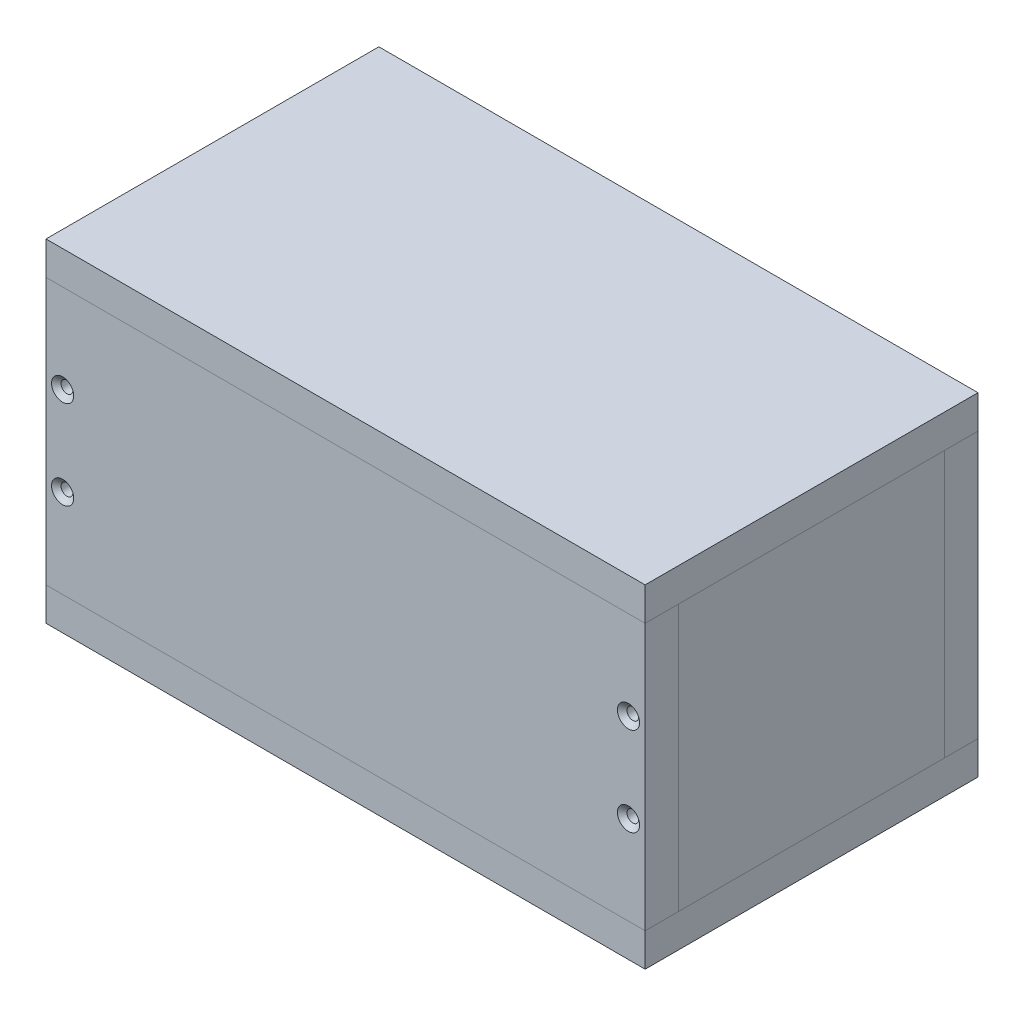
SolidWorks part; units mm, degrees
ref_plane "Front Plane" through (0, 0, 0) normal (0, 0, 1) x (1, 0, 0)
ref_plane "Top Plane" through (0, 0, 0) normal (0, 1, 0) x (1, 0, 0)
ref_plane "Right Plane" through (0, 0, 0) normal (1, 0, 0) x (0, 0, -1)
sketch "Sketch1" plane through (0, 0, 0) normal (0, 1, 0) x (1, 0, 0)
  line L0 (-108.3844, 121.84) -> (-95.6844, 121.84) construction
  line L1 (-101.6, -50.8) -> (101.6, -50.8) construction
  line L2 (-101.6, -50.8) -> (-101.6, 50.8) construction
  line L3 (-101.6, 50.8) -> (101.6, 50.8) construction
  line L4 (101.6, -50.8) -> (101.6, 50.8) construction
  line L5 (-114.3, 63.5) -> (114.3, 63.5) construction
  line L6 (114.3, -63.5) -> (114.3, 63.5) construction
  line L7 (-114.3, -63.5) -> (114.3, -63.5) construction
  line L8 (-114.3, -63.5) -> (-114.3, 63.5) construction
  line L9 (-101.6, 50.8) -> (101.6, -50.8) construction
sketch "Sketch2" plane through (0, 0, 0) normal (0, 1, 0) x (1, 0, 0)
  line L0 (-114.3, 63.5) -> (114.3, 63.5)
  line L1 (114.3, 63.5) -> (114.3, 50.8)
  line L2 (114.3, -63.5) -> (114.3, 63.5) construction
  line L3 (114.3, 50.8) -> (-114.3, 50.8)
  line L4 (-114.3, -63.5) -> (-114.3, 63.5) construction
  line L5 (-114.3, 50.8) -> (-114.3, 63.5)
  line L6 (-101.6, 50.8) -> (101.6, 50.8) construction
  line L7 (-101.6, -50.8) -> (101.6, -50.8) construction
  line L8 (-114.3, -50.8) -> (114.3, -50.8)
  line L9 (-114.3, -50.8) -> (-114.3, -63.5)
  line L10 (-114.3, -63.5) -> (114.3, -63.5)
  line L11 (114.3, -50.8) -> (114.3, -63.5)
extrude "Boss-Extrude1" add sketch "Sketch2" along normal blind 101.6
sketch "Sketch3" plane through (0, 0, 0) normal (0, 1, 0) x (1, 0, 0)
  line L0 (-101.6, -50.8) -> (-101.6, 50.8) construction
  line L1 (101.6, 50.8) -> (114.3, 50.8)
  line L2 (101.6, 50.8) -> (101.6, -50.8)
  line L3 (101.6, -50.8) -> (114.3, -50.8)
  line L4 (114.3, 50.8) -> (114.3, -50.8)
  line L5 (-101.6, -50.8) -> (-114.3, -50.8)
  line L6 (-101.6, -50.8) -> (-101.6, 50.8)
  line L7 (-101.6, 50.8) -> (-114.3, 50.8)
  line L8 (-114.3, -50.8) -> (-114.3, 50.8)
  line L9 (-101.6, -50.8) -> (101.6, -50.8) construction
extrude "Boss-Extrude2" add sketch "Sketch3" along normal blind 101.6 separate body
sketch "Sketch4" plane through (0, 0, 0) normal (0, 1, 0) x (1, 0, 0)
  line L5 (114.3, 63.5) -> (-114.3, 63.5)
  line L6 (114.3, 63.5) -> (114.3, -63.5)
  line L7 (114.3, -63.5) -> (-114.3, -63.5)
  line L8 (-114.3, 63.5) -> (-114.3, -63.5)
extrude "Boss-Extrude3" add sketch "Sketch4" against normal blind 12.7 separate body
sketch "Sketch5" plane through (0, 0, 63.5) normal (0, 0, 1) x (1, 0, 0)
  line L0 (114.3, 101.6) -> (114.3, 0) construction
  line L1 (-114.3, 101.6) -> (114.3, 101.6) construction
  line L2 (-114.3, 101.6) -> (-114.3, 0) construction
  point P0 (-107.95, 67.7333)
  point P1 (-107.95, 33.8667)
  point P2 (107.95, 67.7333)
  point P3 (107.95, 33.8667)
sketch "Sketch6" plane through (0, 101.6, 0) normal (0, 1, 0) x (1, 0, 0)
  line L1 (114.3, -63.5) -> (-114.3, -63.5)
  line L2 (114.3, -63.5) -> (114.3, 63.5)
  line L3 (114.3, 63.5) -> (-114.3, 63.5)
  line L4 (-114.3, -63.5) -> (-114.3, 63.5)
extrude "Boss-Extrude4" add sketch "Sketch6" along normal blind 12.7 separate body
hole_wizard "CSK for #8 Flat Head Machine Screw (100)1" positions "Sketch7" profile "Sketch8" countersink size "#8" standard "ANSI Inch"
sketch "Sketch7" plane through (0, 0, 63.5) normal (0, 0, 1) x (1, 0, 0)
  point P0 (-107.95, 67.7333)
  point P3 (-107.95, 33.8667)
  point P6 (107.95, 67.7333)
  point P9 (107.95, 33.8667)
sketch "Sketch8" plane through (-107.95, 67.7333, 63.5) normal (1, 0, 0) x (0, -1, 0)
  line L0 (0, 0) -> (0, 31.3227)
  line L1 (0, 31.3227) -> (2.2479, 29.972)
  line L2 (2.2479, 29.972) -> (2.2479, 1.6518)
  line L3 (2.2479, 1.6518) -> (4.2164, 0)
  line L5 (4.2164, 0) -> (0, 0)
  line L6 (-2.2479, 1.6518) -> (-4.2164, 0) construction
  line L10 (0, 31.3227) -> (-2.2479, 29.972) construction
  line L11 (0, -6.35) -> (0, 107.95) construction
  dimension "Hole Dia." = 4.4958
  dimension "Hole Depth" = 29.972
  dimension "Near C'Sink Dia." = 8.4328
  dimension "Near C'Sink Angle" = 100
  dimension "Drill Angle" = 118
mirror "Mirror1" about plane through (0, 0, 0) normal (0, 0, 1) of "CSK for #8 Flat Head Machine Screw (100)1"
sketch "Sketch9" plane through (0, -12.7, 0) normal (0, -1, 0) x (1, 0, 0)
  line L1 (-114.3, -63.5) -> (-114.3, -50.8) construction
  line L2 (114.3, -50.8) -> (114.3, -63.5) construction
  line L3 (114.3, -63.5) -> (-114.3, -63.5) construction
  line L4 (-114.3, 63.5) -> (114.3, 63.5) construction
  point P0 (-57.15, 57.15)
  point P1 (57.15, 57.15)
  point P2 (-57.15, -57.15)
  point P3 (57.15, -57.15)
hole_wizard "CSK for #8 Flat Head Machine Screw (100)2" positions "Sketch10" profile "Sketch11" countersink size "#8" standard "ANSI Inch"
sketch "Sketch10" plane through (0, -12.7, 0) normal (0, -1, 0) x (-1, 0, 0)
  point P0 (-57.15, 57.15)
  point P3 (57.15, 57.15)
  point P6 (57.15, -57.15)
  point P9 (-57.15, -57.15)
sketch "Sketch11" plane through (57.15, -12.7, -57.15) normal (1, 0, 0) x (0, 0, -1)
  line L0 (0, 0) -> (0, 31.3227)
  line L1 (0, 31.3227) -> (2.2479, 29.972)
  line L2 (2.2479, 29.972) -> (2.2479, 1.6518)
  line L3 (2.2479, 1.6518) -> (4.2164, 0)
  line L5 (4.2164, 0) -> (0, 0)
  line L6 (-2.2479, 1.6518) -> (-4.2164, 0) construction
  line L10 (0, 31.3227) -> (-2.2479, 29.972) construction
  line L11 (0, -6.35) -> (0, 107.95) construction
  dimension "Hole Dia." = 4.4958
  dimension "Hole Depth" = 29.972
  dimension "Near C'Sink Dia." = 8.4328
  dimension "Near C'Sink Angle" = 100
  dimension "Drill Angle" = 118
sketch "Sketch12" plane through (0, 101.6, 0) normal (0, 1, 0) x (1, 0, 0)
  line L0 (-114.3, 50.8) -> (114.3, 50.8) construction
  line L1 (76.2, 50.8) -> (63.5, 50.8)
  line L2 (76.2, 50.8) -> (76.2, -50.8)
  line L3 (76.2, -50.8) -> (63.5, -50.8)
  line L4 (63.5, 50.8) -> (63.5, -50.8)
  line L5 (114.3, -50.8) -> (-114.3, -50.8) construction
  line L6 (101.6, 50.8) -> (101.6, -50.8) construction
extrude "Boss-Extrude5" add sketch "Sketch12" against normal up to next separate body
sketch "Sketch13" plane through (0, 101.6, 0) normal (0, 1, 0) x (1, 0, 0)
  line L0 (-43.3605, 50.8) -> (-101.6, -7.4395)
  line L1 (-114.3, 50.8) -> (114.3, 50.8) construction
  line L2 (-101.6, -50.8) -> (-101.6, 50.8) construction
  line L3 (-101.6, -7.4395) -> (-101.6, -25.4)
  line L4 (-101.6, -25.4) -> (-25.4, 50.8)
  line L5 (-25.4, 50.8) -> (-43.3605, 50.8)
  dimension "D1" = 12.7
  dimension "D2" = 45
  dimension "D3" = 25.4
extrude "Boss-Extrude6" add sketch "Sketch13" against normal up to next separate body
sketch "Sketch14" plane through (0, 0, 0) normal (0, 1, 0) x (1, 0, 0)
  line L0 (31.75, -50.8) -> (31.75, -25.4)
  line L1 (114.3, -50.8) -> (-114.3, -50.8) construction
  line L2 (31.75, -25.4) -> (-19.05, -25.4)
  line L3 (-19.05, -25.4) -> (-44.45, -50.8)
  line L4 (-44.45, -50.8) -> (31.75, -50.8)
extrude "Boss-Extrude8" add sketch "Sketch14" along normal blind 12.7 separate body contours L3 L4 L0 L2
equation "\"MT\"= .5"
equation "\"D3@Sketch1\"=\"MT\""
equation "\"BH\"= 4"
equation "\"D1@Boss-Extrude1\"=\"BH\""
equation "\"D1@Boss-Extrude2\"=\"BH\""
equation "\"D1@Boss-Extrude4\"=\"MT\""
equation "\"D4@Sketch5\"=\"MT\"/2"
equation "\"D1@Sketch5\"=\"MT\"/2"
equation "\"D3@Sketch5\"=\"BH\"/3"
equation "\"D2@Sketch5\"=\"BH\"/3"
equation "\"D1@Boss-Extrude3\"=\"MT\""
equation "\"D4@Sketch1\"=\"MT\""
equation "\"BW\"=5"
equation "\"D1@Sketch1\"=\"BW\""
equation "\"BL\"=9"
equation "\"D2@Sketch1\"=\"BL\""
equation "\"D1@Sketch9\"=\"BL\"/4"
equation "\"D2@Sketch9\"=\"BL\"/4"
equation "\"D3@Sketch9\"=\"MT\"/2"
equation "\"D4@Sketch9\"=\"MT\"/2"
equation "\"D1@Sketch12\"=\"MT\""
equation "\"D1@Sketch14\"=\"MT\"*2"
equation "\"D1@Boss-Extrude8\" = \"MT\""
